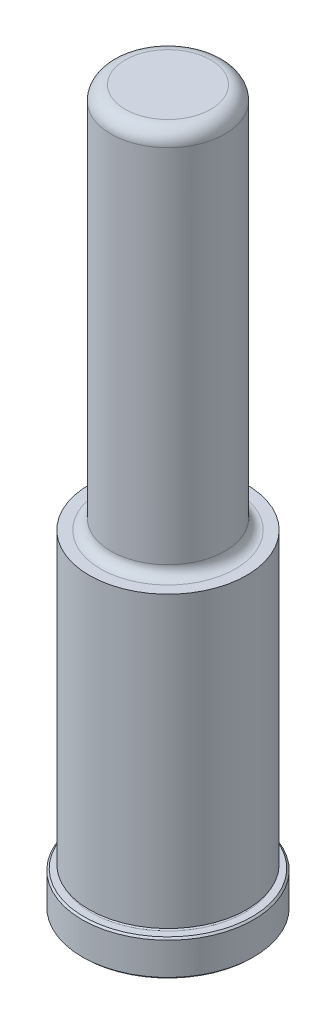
SolidWorks part; units mm, degrees
ref_plane "Front Plane" through (0, 0, 0) normal (0, 0, 1) x (1, 0, 0)
ref_plane "Top Plane" through (0, 0, 0) normal (0, 1, 0) x (1, 0, 0)
ref_plane "Right Plane" through (0, 0, 0) normal (1, 0, 0) x (0, 0, -1)
sketch "Sketch1" plane through (0, 0, 0) normal (1, 0, 0) x (0, 0, -1)
  line L0 (0, 0) -> (19.05, 0)
  line L1 (19.05, 0) -> (19.05, 7.9248)
  line L2 (19.05, 7.9248) -> (17.0688, 7.9248)
  line L3 (16.6878, 2.6782) -> (16.6878, 5.9795) construction
  line L4 (17.0688, 8.6868) -> (17.4752, 8.6868)
  line L5 (17.4752, 8.6868) -> (17.4752, 73.025)
  line L6 (17.4752, 73.025) -> (14.9733, 73.025)
  line L7 (12.6873, 75.311) -> (12.6873, 158.75)
  line L9 (12.6873, 158.75) -> (0, 158.75)
  line L10 (0, 158.75) -> (0, 0)
  line L11 (0, 0) -> (0, -7.2694) construction
  arc A0 (17.0688, 8.6868) -> (17.0688, 7.9248) centre (17.0688, 8.3058) ccw
  arc A1 (14.9733, 73.025) -> (12.6873, 75.311) centre (14.9733, 75.311) cw
  point P2 (12.6873, 158.75)
  point P14 (12.6873, 158.8662)
  point P19 (12.6873, 73.025)
  dimension "D14" = 0.762
  dimension "D8" = 2.286
  dimension "T" = 7.9248
  dimension "D2" = 0.762
  dimension "M" = 38.1
  dimension "B" = 34.9504
  dimension "L" = 158.75
  dimension "D7" = 0.7874
  dimension "A" = 73.025
  dimension "D" = 25.3746
  dimension "D15" = 85.725
revolve "Revolve1" add sketch "Sketch1" angle 360 about L11
chamfer "Chamfer1" distance 0.381 angle 45 2 edges at (0, 0, 19.05) (0, 7.9248, 19.05)
fillet "Fillet7" radius 3.175 1 edges at (0, 158.75, 12.6873)
